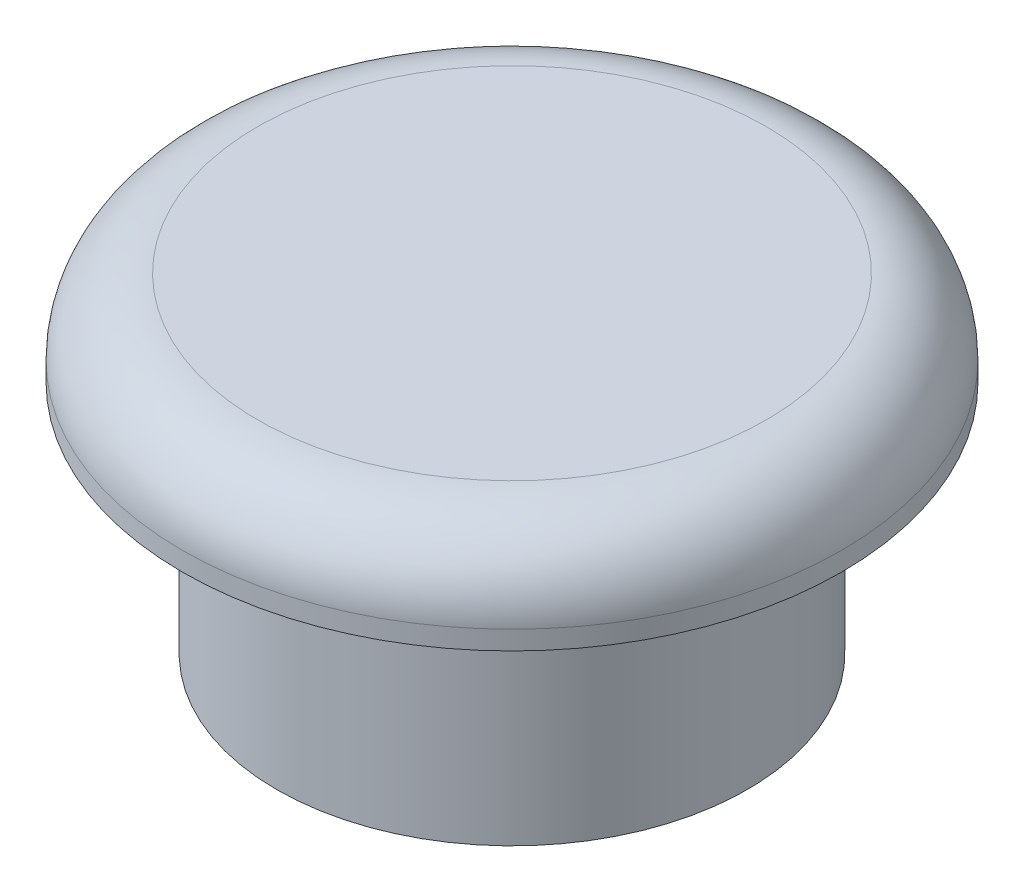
SolidWorks part; units mm, degrees
ref_plane "Plan de face" through (0, 0, 0) normal (0, 0, 1) x (1, 0, 0)
ref_plane "Plan de dessus" through (0, 0, 0) normal (0, 1, 0) x (1, 0, 0)
ref_plane "Plan de droite" through (0, 0, 0) normal (1, 0, 0) x (0, 0, -1)
sketch "Esquisse1" plane through (0, 0, 0) normal (0, 0, 1) x (1, 0, 0)
  line L0 (0, 22.4041) -> (0, 0) construction
  line L1 (0, 0) -> (13.8538, 0) construction
  line L2 (2.5, 0) -> (2.5, 2.5)
  line L3 (2.5, 2.5) -> (3.5, 2.5)
  line L4 (3.5, 2.5) -> (3.5, 3.5)
  line L5 (3.5, 3.5) -> (0, 3.5)
  line L6 (2.5, 0) -> (1.5, 0)
  line L7 (1.5, 0) -> (1.5, 2.5)
  line L8 (1.5, 2.5) -> (0, 2.5)
  line L9 (0, 2.5) -> (0, 3.5)
  dimension "D1" = 2.5
  dimension "D2" = 1.5
  dimension "D3" = 3.5
  dimension "D4" = 2.5
  dimension "D5" = 3.5
  dimension "D6" = 2.5
revolve "Révolution1" add sketch "Esquisse1" angle 360 about L0
fillet "Congé2" radius 0.8 1 edges at (0, 3.5, 3.5)
